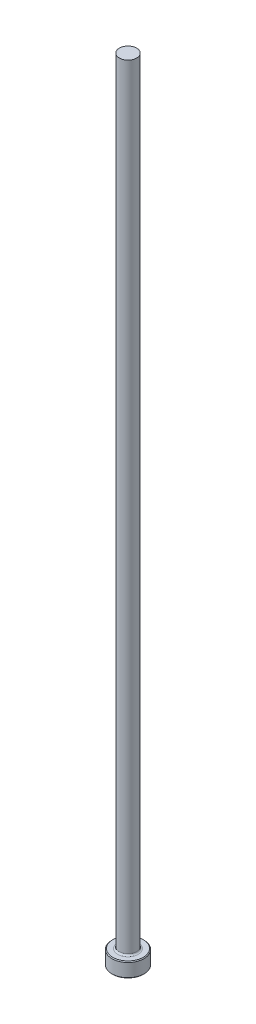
SolidWorks part; units mm, degrees
ref_plane "Front Plane" through (0, 0, 0) normal (0, 0, 1) x (1, 0, 0)
ref_plane "Top Plane" through (0, 0, 0) normal (0, 1, 0) x (1, 0, 0)
ref_plane "Right Plane" through (0, 0, 0) normal (1, 0, 0) x (0, 0, -1)
sketch "Sketch1" plane through (0, 0, 0) normal (0, 0, 1) x (1, 0, 0)
  line L0 (0, 259.9588) -> (0, -15.1925) construction
  line L1 (0, 0) -> (-5.1562, 0)
  line L2 (-5.1562, 0) -> (-5.1562, 4.7498)
  line L3 (-5.1562, 4.7498) -> (-2.7775, 4.7498)
  line L4 (-2.7775, 4.7498) -> (-2.7775, 254)
  line L5 (-2.7775, 254) -> (0, 254)
  line L6 (0, 254) -> (0, 0)
  dimension "L" = 254
  dimension "H" = 10.3124
  dimension "T" = 4.7498
  dimension "D" = 5.555
revolve "Revolve1" add sketch "Sketch1" angle 360 about L0
chamfer "Chamfer1" distance 0.254 angle 45 2 edges at (0, 4.7498, 5.1562) (0, 0, 5.1562)
fillet "Fillet1" radius 0.508 1 edges at (0, 4.7498, 2.7775)
sketch "Pocket Sketch" plane through (0, 0, 0) normal (0, 0, 1) x (1, 0, 0)
  line L0 (-5.5531, 0) -> (-5.5531, 4.7752)
  line L1 (-5.5531, 4.7752) -> (-3.7379, 4.7752)
  line L2 (-2.9759, 5.5372) -> (-2.9759, 22.225)
  line L3 (-2.9759, 22.225) -> (0, 22.225)
  line L4 (0, 22.225) -> (0, 0)
  line L5 (0, 0) -> (-5.5531, 0)
  line L6 (0, 12.6104) -> (0, -2.4989) construction
  line L7 (-5.1562, 4.4958) -> (-5.1562, 0.254) construction
  line L8 (4.9022, 4.7498) -> (-4.9022, 4.7498) construction
  line L9 (-2.7775, 254) -> (-2.7775, 5.2578) construction
  line L10 (-3.7379, 4.7752) -> (-2.9759, 5.5372)
  point P3 (-2.9759, 4.7752)
  dimension "D1" = 11.1061
  dimension "D2" = 0.3969
  dimension "D3" = 0.0254
  dimension "D4" = 0.1984
  dimension "D5" = 5.9519
  dimension "D6" = 22.225
